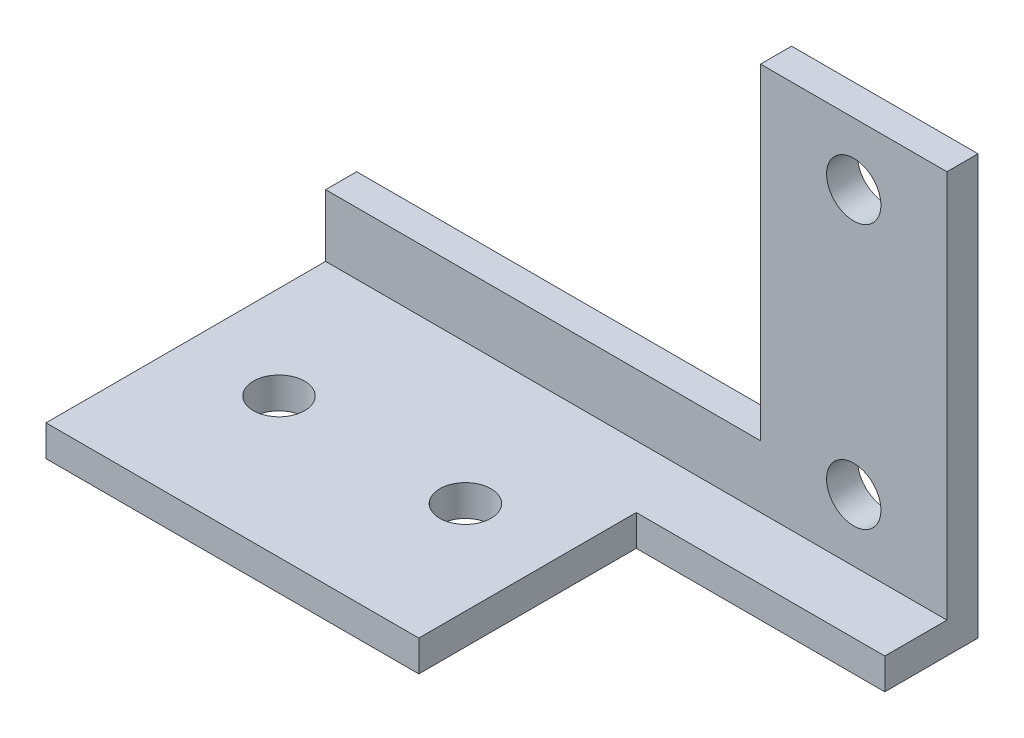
SolidWorks part; units mm, degrees
ref_plane "Front Plane" through (0, 0, 0) normal (0, 0, 1) x (1, 0, 0)
ref_plane "Top Plane" through (0, 0, 0) normal (0, 1, 0) x (1, 0, 0)
ref_plane "Right Plane" through (0, 0, 0) normal (1, 0, 0) x (0, 0, -1)
sketch "Sketch1" plane through (0, 0, 0) normal (1, 0, 0) x (0, 0, -1)
  line L0 (0, 27) -> (0, 0)
  line L1 (0, 0) -> (-20, 0)
  line L2 (-20, 0) -> (-20, 2)
  line L3 (-20, 2) -> (-2, 2)
  line L4 (-2, 2) -> (-2, 27)
  line L5 (-2, 27) -> (0, 27)
  dimension "D1" = 2
  dimension "D2" = 2
  dimension "D3" = 27
  dimension "D4" = 20
extrude "Extrude1" add sketch "Sketch1" along normal blind 40
sketch "Sketch3" plane through (0, 0, 0) normal (0, 0, -1) x (-1, 0, 0)
  line L0 (-40, 0) -> (-40, 27) construction
  line L1 (0, 27) -> (-28, 27)
  line L2 (0, 27) -> (0, 6)
  line L3 (0, 6) -> (-28, 6)
  line L4 (-28, 27) -> (-28, 6)
  dimension "D1" = 21
  dimension "D2" = 12
extrude "Extrude3" cut sketch "Sketch3" against normal blind 40
sketch "Sketch4" plane through (0, 2, 0) normal (0, 1, 0) x (1, 0, 0)
  line L0 (40, -2) -> (0, -2) construction
  line L1 (40, -20) -> (24, -20)
  line L2 (40, -20) -> (40, -6)
  line L3 (40, -6) -> (24, -6)
  line L4 (24, -20) -> (24, -6)
  dimension "D1" = 16
  dimension "D2" = 4
extrude "Extrude4" cut sketch "Sketch4" against normal blind 40
sketch "Sketch5" plane through (0, 0, 0) normal (0, 0, -1) x (-1, 0, 0)
  line L0 (-34, 27) -> (-34, 0) construction
  line L1 (-40, 27) -> (-28, 27) construction
  line L2 (-40, 0) -> (0, 0) construction
  circle A0 centre (-34, 23) radius 1.75
  circle A1 centre (-34, 6) radius 1.75
  dimension "D1" = 4
  dimension "D2" = 6
  dimension "D3" = 3.5
extrude "Extrude5" cut sketch "Sketch5" against normal blind 40
sketch "Sketch6" plane through (0, 2, 0) normal (0, 1, 0) x (1, 0, 0)
  line L0 (0, -11) -> (24, -11) construction
  line L1 (0, -2) -> (0, -20) construction
  line L2 (24, -6) -> (24, -20) construction
  line L3 (24, -20) -> (0, -20) construction
  point P8 (6, -11)
  point P9 (18, -11)
  dimension "D1" = 9
  dimension "D2" = 6
  dimension "D3" = 12
hole_wizard "M4 Tapped Hole1" positions "3DSketch1" profile "Sketch8" tap size "M4" standard "ISO"
sketch3d "3DSketch1"
  point P0 (6, 2, 11)
  point P3 (18, 2, 11)
sketch "Sketch8" plane through (6, 2, 11) normal (1, 0, 0) x (0, 0, 1)
  line L0 (0, 0) -> (0, 2)
  line L1 (0, 2) -> (1.65, 2)
  line L2 (1.65, 2) -> (1.65, 0)
  line L5 (1.65, 0) -> (0, 0)
  line L11 (0, -6.35) -> (0, 107.95) construction
  dimension "Thru Tap Drill Dia." = 3.3
  dimension "Thru Tap Drill Depth" = 2
